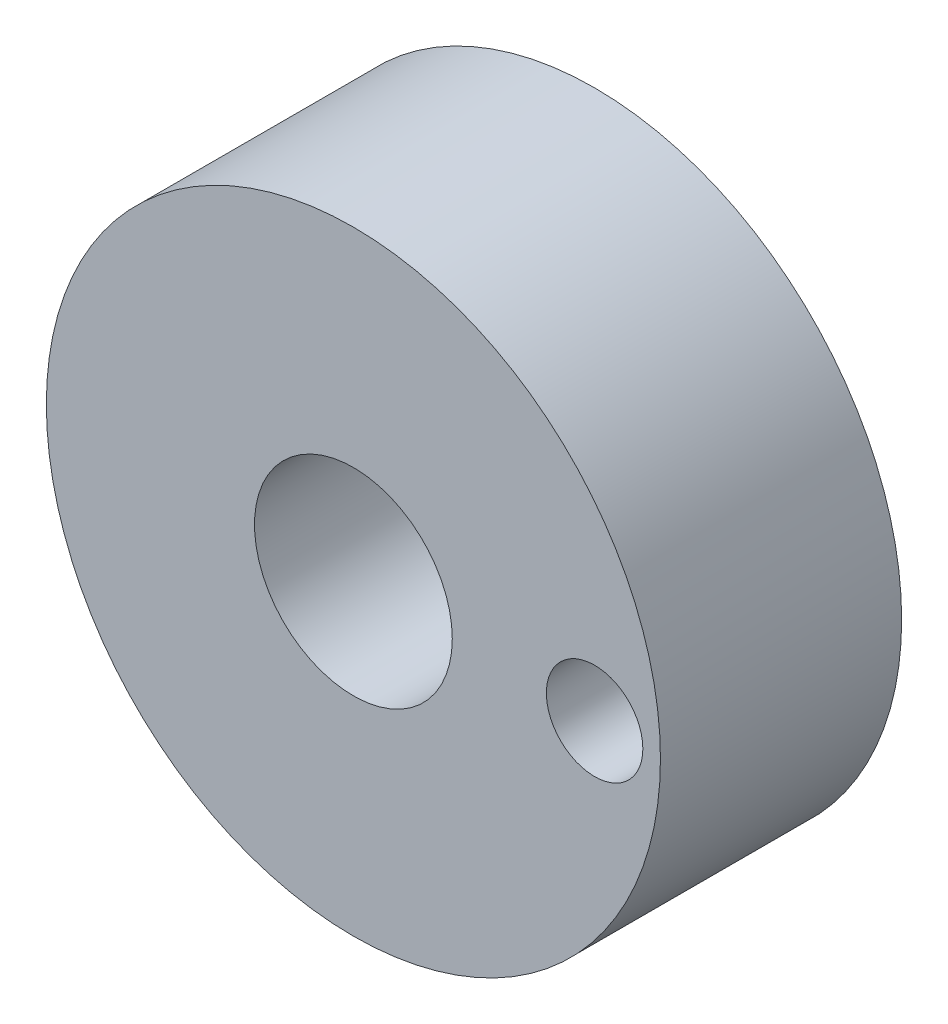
SolidWorks part; units mm, degrees
ref_plane "Front Plane" through (0, 0, 0) normal (0, 0, 1) x (1, 0, 0)
ref_plane "Top Plane" through (0, 0, 0) normal (0, 1, 0) x (1, 0, 0)
ref_plane "Right Plane" through (0, 0, 0) normal (1, 0, 0) x (0, 0, -1)
sketch "Sketch1" plane through (0, 0, 0) normal (0, 0, 1) x (1, 0, 0)
  circle A0 centre (0, 0) radius 6.365
extrude "Boss-Extrude1" add sketch "Sketch1" along normal blind 5
sketch "Sketch2" plane through (0, 0, 5) normal (0, 0, 1) x (1, 0, 0)
  circle A0 centre (0, 0) radius 2.05
  circle A1 centre (5, 0) radius 1
  dimension "D1" = 5
extrude "Cut-Extrude1" cut sketch "Sketch2" against normal blind 5
